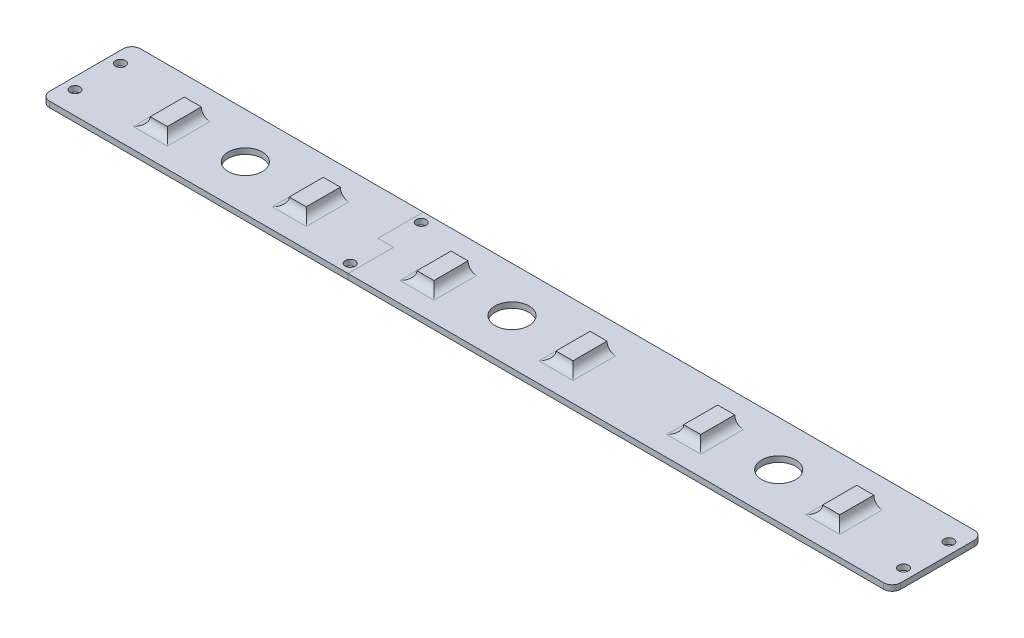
SolidWorks part; units mm, degrees
ref_plane "Front Plane" through (0, 0, 0) normal (0, 0, 1) x (1, 0, 0)
ref_plane "Top Plane" through (0, 0, 0) normal (0, 1, 0) x (1, 0, 0)
ref_plane "Right Plane" through (0, 0, 0) normal (1, 0, 0) x (0, 0, -1)
sketch "Sketch1" plane through (0, 0, 0) normal (0, 1, 0) x (1, 0, 0)
  line L1 (21.5, 6) -> (27.5, 6)
  line L2 (21.5, 6) -> (21.5, -6)
  line L3 (21.5, -6) -> (27.5, -6)
  line L4 (27.5, 6) -> (27.5, -6)
  line L5 (21.5, 6) -> (27.5, -6) construction
  line L6 (21.5, -6) -> (27.5, 6) construction
  line L7 (-27.5, 6) -> (-21.5, 6)
  line L8 (-27.5, 6) -> (-27.5, -6)
  line L9 (-27.5, -6) -> (-21.5, -6)
  line L10 (-21.5, 6) -> (-21.5, -6)
  line L11 (-27.5, 6) -> (-21.5, -6) construction
  line L12 (-27.5, -6) -> (-21.5, 6) construction
  point P0 (24.5, 0)
  point P5 (-24.5, 0)
  dimension "D1" = 49
  dimension "D2" = 24.5
  dimension "D3" = 6
  dimension "D4" = 12
extrude "Boss-Extrude1" add sketch "Sketch1" along normal blind 3
sketch "Sketch2" plane through (0, 0, -6) normal (0, 0, -1) x (-1, 0, 0)
  line L8 (22.25, 0.75) -> (26.75, 0.75)
  line L9 (26.75, 0.75) -> (26.75, 2.25)
  line L10 (26.75, 2.25) -> (22.25, 2.25)
  line L11 (22.25, 2.25) -> (22.25, 0.75)
  line L12 (22.25, 0.75) -> (26.75, 0.75)
  line L13 (26.75, 0.75) -> (26.75, 2.25)
  line L14 (26.75, 2.25) -> (22.25, 2.25)
  line L15 (22.25, 2.25) -> (22.25, 0.75)
  line L20 (-26.75, 0.75) -> (-22.25, 0.75)
  line L21 (-22.25, 0.75) -> (-22.25, 2.25)
  line L22 (-22.25, 2.25) -> (-26.75, 2.25)
  line L23 (-26.75, 2.25) -> (-26.75, 0.75)
  line L24 (-26.75, 0.75) -> (-22.25, 0.75)
  line L25 (-22.25, 0.75) -> (-22.25, 2.25)
  line L26 (-22.25, 2.25) -> (-26.75, 2.25)
  line L27 (-26.75, 2.25) -> (-26.75, 0.75)
  dimension "D2" = 0.75
  dimension "D1" = 0.75
extrude "Cut-Extrude1" cut sketch "Sketch2" against normal blind 10
sketch "Sketch3" plane through (0, 0, 0) normal (0, -1, 0) x (1, 0, 0)
  line L1 (-150, 16) -> (150, 16)
  line L2 (-150, 16) -> (-150, -16)
  line L3 (-150, -16) -> (150, -16)
  line L4 (150, 16) -> (150, -16)
  line L5 (-150, 16) -> (150, -16) construction
  line L6 (-150, -16) -> (150, 16) construction
  point P0 (0, 0)
  dimension "D1" = 300
  dimension "D2" = 32
extrude "Boss-Extrude2" add sketch "Sketch3" along normal blind 2
fillet "Fillet1" radius 3 6 edges at (24.5, 0, 6) (-24.5, 0, 6) (-27.5, 0, 0) (-21.5, 0, 0) (21.5, 0, 0) (27.5, 0, 0)
sketch "Sketch4" plane through (0, 0, 0) normal (0, 1, 0) x (1, 0, 0)
  line L0 (-47, 28.2982) -> (-47, -55.8679) construction
  line L1 (47, 28.2352) -> (47, -44.8654) construction
  line L4 (-2.75, 0) -> (2.75, 0) construction
  line L5 (0, -2.75) -> (0, 2.75) construction
  circle A0 centre (0, 0) radius 6
  circle A3 centre (-146, -8) radius 1.75
  circle A4 centre (146, -8) radius 1.75
  circle A5 centre (-94, 0) radius 6
  circle A6 centre (94, 0) radius 6
  circle A7 centre (146, 8) radius 1.75
  circle A8 centre (-146, 8) radius 1.75
  circle A9 centre (44.5, 12.5) radius 1.75 construction
  circle A10 centre (44.5, -12.5) radius 1.75 construction
  circle A11 centre (-44.5, -12.5) radius 1.75
  circle A12 centre (-44.5, 12.5) radius 1.75
  dimension "D1" = 12
  dimension "D2" = 292
  dimension "D4" = 3.5
  dimension "D5" = 94
  dimension "D6" = 94
  dimension "D10" = 146
  dimension "D11" = 3.5
  dimension "D3" = 8
  dimension "D7" = 47
  dimension "D8" = 47
  dimension "D9" = 8
  dimension "D12" = 12.5
  dimension "D13" = 25
  dimension "D14" = 138.5
extrude "Cut-Extrude2" cut sketch "Sketch4" against normal through all both and the other way through all
fillet "Fillet2" radius 3 4 edges at (-150, -1, 16) (-150, -1, -16) (150, -1, -16) (150, -1, 16)
ref_plane "Plane1" through (47, 0, 0) normal (1, 0, 0) x (0, 0, -1)
mirror "Mirror1" about plane through (47, 0, 0) normal (1, 0, 0) of "Fillet1", "Boss-Extrude1", "Cut-Extrude1"
ref_plane "Plane3" through (-47, 0, 0) normal (-1, 0, 0) x (0, 0, 1)
mirror "Mirror3" about plane through (-47, 0, 0) normal (-1, 0, 0) of "Fillet1", "Cut-Extrude1", "Boss-Extrude1"
sketch "Sketch5" plane through (0, 0, 0) normal (0, 1, 0) x (1, 0, 0)
  line L0 (47.25, 16) -> (47.25, 0) construction
  line L1 (-147, 16) -> (147, 16) construction
  line L2 (47.25, 0) -> (41.75, 0) construction
  line L3 (41.75, 0) -> (41.75, -16) construction
  line L4 (147, -16) -> (-147, -16) construction
  line L5 (0, -2.75) -> (0, 2.75) construction
  line L6 (-41.75, 0) -> (-41.75, -16)
  line L7 (-47.25, 0) -> (-41.75, 0)
  line L8 (-47.25, 16) -> (-47.25, 0)
  dimension "D1" = 41.75
  dimension "D3" = 47.25
split "Split1" trim tools "Sketch5" bodies to split 109 resulting bodies 112 113
